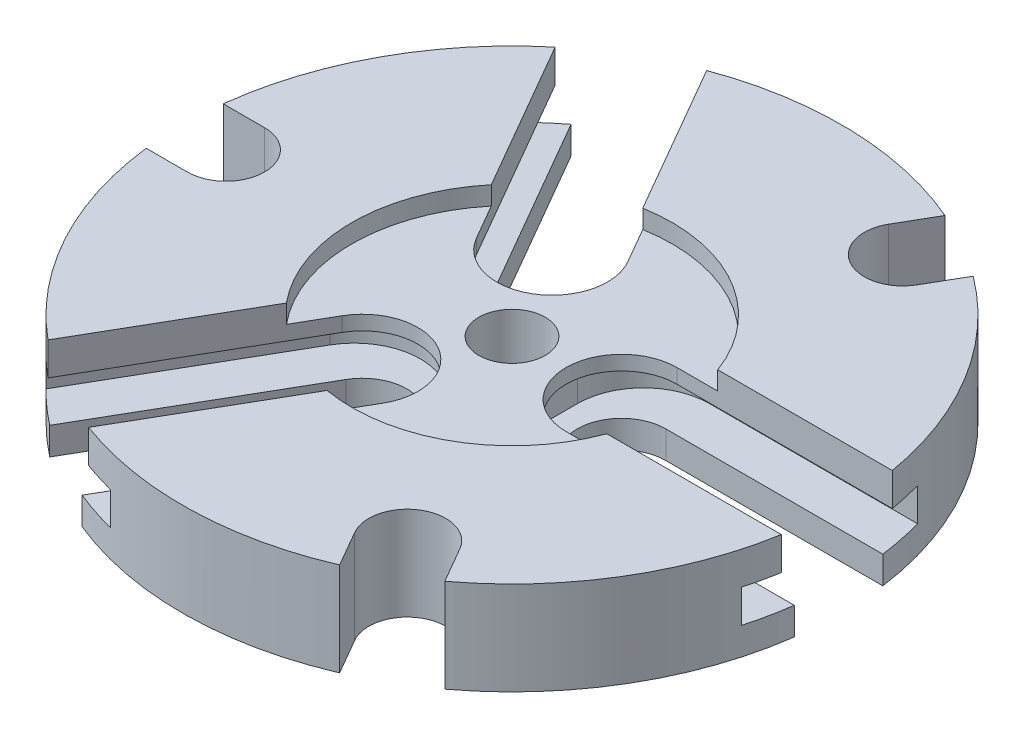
SolidWorks part; units mm, degrees
ref_plane "Front/Back" through (0, 0, 0) normal (0, 0, 1) x (1, 0, 0)
ref_plane "Top/Bottom" through (0, 0, 0) normal (0, 1, 0) x (1, 0, 0)
ref_plane "Right/Left" through (0, 0, 0) normal (1, 0, 0) x (0, 0, -1)
sketch "Sketch1" plane through (0, 0, 0) normal (0, 1, 0) x (1, 0, 0)
  circle A0 centre (0, 0) radius 47.5488
  dimension "D1" = 95.0976
extrude "Extrude1" add sketch "Sketch1" along normal mid plane 13.4874
sketch "Sketch2" plane through (0, 6.7437, 0) normal (0, 1, 0) x (-1, 0, 0)
  line L0 (0, 0) -> (0, 56.0524) construction
  line L1 (0, 0) -> (-50.2209, 0) construction
  line L2 (-15.7988, 6.3881) -> (-47.1177, 6.3881)
  line L3 (-15.7988, -6.3881) -> (-47.1177, -6.3881)
  arc A0 (-15.7988, -6.3881) -> (-15.7988, 6.3881) centre (-15.7988, 0) ccw
  circle A2 centre (0, 0) radius 47.5488
  arc A3 (-47.1177, 6.3881) -> (-47.1177, -6.3881) centre (0, 0) ccw
  dimension "D2" = 6.3881
  dimension "D3" = 15.7988
  dimension "D1" = 0
extrude "Cut-Extrude1" cut sketch "Sketch2" against normal through all
pattern_circular "CirPattern1" count 3 over 360 about axis through (0, 6.7437, 0) along (0, -1, 0) of "Cut-Extrude1"
sketch "Sketch3" plane through (0, 6.7437, 0) normal (0, 1, 0) x (-1, 0, 0)
  line L0 (0, 0) -> (-50.2209, 0) construction
  line L2 (-15.7988, -12.7) -> (-45.8214, -12.7)
  line L3 (-6.2738, -3.175) -> (-6.2738, 3.175)
  line L4 (-15.7988, 12.7) -> (-45.8214, 12.7)
  line L11 (18.0266, -43.9992) -> (2.3671, -16.8762)
  line L12 (13.4317, -10.4881) -> (29.0911, -37.6111)
  line L13 (29.0911, 37.6111) -> (13.4317, 10.4881)
  line L14 (2.3671, 16.8762) -> (18.0266, 43.9992)
  line L15 (-47.1177, 6.3881) -> (-15.7988, 6.3881)
  line L16 (-15.7988, -6.3881) -> (-47.1177, -6.3881)
  line L21 (-47.1177, 6.3881) -> (-15.7988, 6.3881)
  line L22 (-15.7988, -6.3881) -> (-47.1177, -6.3881)
  arc A0 (-15.7988, 12.7) -> (-6.2738, 3.175) centre (-15.7988, 3.175) cw
  arc A1 (-15.7988, -12.7) -> (-6.2738, -3.175) centre (-15.7988, -3.175) ccw
  arc A6 (13.4317, -10.4881) -> (2.3671, -16.8762) centre (7.8994, -13.6822) ccw
  arc A7 (29.0911, -37.6111) -> (29.0911, 37.6111) centre (0, 0) ccw
  arc A8 (2.3671, 16.8762) -> (13.4317, 10.4881) centre (7.8994, 13.6822) ccw
  arc A9 (18.0266, 43.9992) -> (-47.1177, 6.3881) centre (0, 0) ccw
  arc A10 (-15.7988, -6.3881) -> (-15.7988, 6.3881) centre (-15.7988, 0) ccw
  arc A11 (-47.1177, -6.3881) -> (18.0266, -43.9992) centre (0, 0) ccw
  arc A15 (-45.8214, 12.7) -> (-47.1177, 6.3881) centre (0, 0) ccw
  arc A16 (-15.7988, -6.3881) -> (-15.7988, 6.3881) centre (-15.7988, 0) ccw
  arc A17 (-47.1177, -6.3881) -> (-45.8214, -12.7) centre (0, 0) ccw
  point P16 (-6.2738, 12.7)
  dimension "D4" = 9.525
  dimension "D2" = 9.525
  dimension "D3" = 9.525
  dimension "D5" = 25.4
  dimension "D1" = 0
extrude "Cut-Extrude2" cut sketch "Sketch3" against normal blind 9.525
pattern_circular "CirPattern4" count 3 over 360 about axis through (0, 6.7437, 0) along (0, -1, 0) of "Cut-Extrude2"
sketch "Sketch5" plane through (0, 6.7437, 0) normal (0, 1, 0) x (-1, 0, 0)
  line L0 (-46.8708, -8.001) -> (-15.7988, -8.001)
  line L1 (-46.8708, 8.001) -> (-15.7988, 8.001)
  line L2 (-45.8214, -12.7) -> (-15.7988, -12.7) construction
  line L3 (-6.2738, -3.175) -> (-6.2738, 3.175) construction
  line L4 (-15.7988, 12.7) -> (-45.8214, 12.7) construction
  line L5 (-45.8214, -12.7) -> (-15.7988, -12.7)
  line L6 (-6.2738, -3.175) -> (-6.2738, 3.175)
  line L7 (-15.7988, 12.7) -> (-45.8214, 12.7)
  arc A0 (-15.7988, -8.001) -> (-15.7988, 8.001) centre (-15.7988, 0) ccw
  arc A3 (-15.7988, -12.7) -> (-6.2738, -3.175) centre (-15.7988, -3.175) ccw construction
  arc A4 (-6.2738, 3.175) -> (-15.7988, 12.7) centre (-15.7988, 3.175) ccw construction
  arc A5 (-15.7988, -12.7) -> (-6.2738, -3.175) centre (-15.7988, -3.175) ccw
  arc A6 (-6.2738, 3.175) -> (-15.7988, 12.7) centre (-15.7988, 3.175) ccw
  arc A7 (-45.8214, 12.7) -> (-47.1177, 6.3881) centre (0, 0) ccw construction
  arc A8 (-47.1177, -6.3881) -> (-45.8214, -12.7) centre (0, 0) ccw construction
  arc A9 (-45.8214, 12.7) -> (-46.8708, 8.001) centre (0, 0) ccw
  arc A10 (-46.8708, -8.001) -> (-45.8214, -12.7) centre (0, 0) ccw
  dimension "D1" = 16.002
extrude "Extrude3" add sketch "Sketch5" against normal blind 4.7498
pattern_circular "CirPattern5" count 3 over 360 about axis through (0, 0, 0) along (0, 1, 0) of "Extrude3"
sketch "Sketch6" plane through (0, 6.7437, 0) normal (0, 1, 0) x (-1, 0, 0)
  circle A0 centre (0, 0) radius 4.7879
  dimension "D1" = 9.5758
extrude "Cut-Extrude3" cut sketch "Sketch6" against normal through all
sketch "Sketch7" plane through (0, 6.7437, 0) normal (0, 1, 0) x (-1, 0, 0)
  circle A0 centre (0, 0) radius 23.114
  dimension "D1" = 46.228
extrude "Cut-Extrude4" cut sketch "Sketch7" against normal blind 2.667
sketch "Sketch8" plane through (0, -6.7437, 0) normal (0, -1, 0) x (1, 0, 0)
  line L0 (0, 0) -> (0, 58.7598) construction
  line L1 (0, 0) -> (57.2883, 0) construction
  line L2 (0, 0) -> (34.2839, 59.3815) construction
  line L3 (25.4494, 32.9671) -> (28.4234, 38.1182)
  line L4 (15.8256, 38.5233) -> (18.7997, 43.6745)
  line L11 (-2.3671, -16.8762) -> (-18.0266, -43.9992)
  line L12 (47.1177, -6.3881) -> (15.7988, -6.3881)
  line L13 (15.7988, 6.3881) -> (47.1177, 6.3881)
  line L14 (-18.0266, 43.9992) -> (-2.3671, 16.8762)
  line L15 (-13.4317, 10.4881) -> (-29.0911, 37.6111)
  line L16 (-29.0911, -37.6111) -> (-13.4317, -10.4881)
  arc A0 (15.8256, 38.5233) -> (25.4494, 32.9671) centre (20.6375, 35.7452) ccw
  circle A1 centre (0, 0) radius 41.275 construction
  arc A7 (-2.3671, -16.8762) -> (-13.4317, -10.4881) centre (-7.8994, -13.6822) ccw
  arc A8 (-18.0266, -43.9992) -> (47.1177, -6.3881) centre (0, 0) ccw
  arc A9 (15.7988, 6.3881) -> (15.7988, -6.3881) centre (15.7988, 0) ccw
  arc A10 (47.1177, 6.3881) -> (-18.0266, 43.9992) centre (0, 0) ccw
  arc A11 (-13.4317, 10.4881) -> (-2.3671, 16.8762) centre (-7.8994, 13.6822) ccw
  arc A12 (-29.0911, 37.6111) -> (-29.0911, -37.6111) centre (0, 0) ccw
  arc A16 (28.4234, 38.1182) -> (18.7997, 43.6745) centre (0, 0) ccw
  dimension "D1" = 11.1125
  dimension "D4" = 82.55
  dimension "D2" = 30
  dimension "D3" = 0
extrude "Cut-Extrude5" cut sketch "Sketch8" against normal up to surface (13.4874 mm away)
pattern_circular "CirPattern6" count 3 over 360 about axis through (0, 6.7437, 0) along (0, -1, 0) of "Cut-Extrude5"
